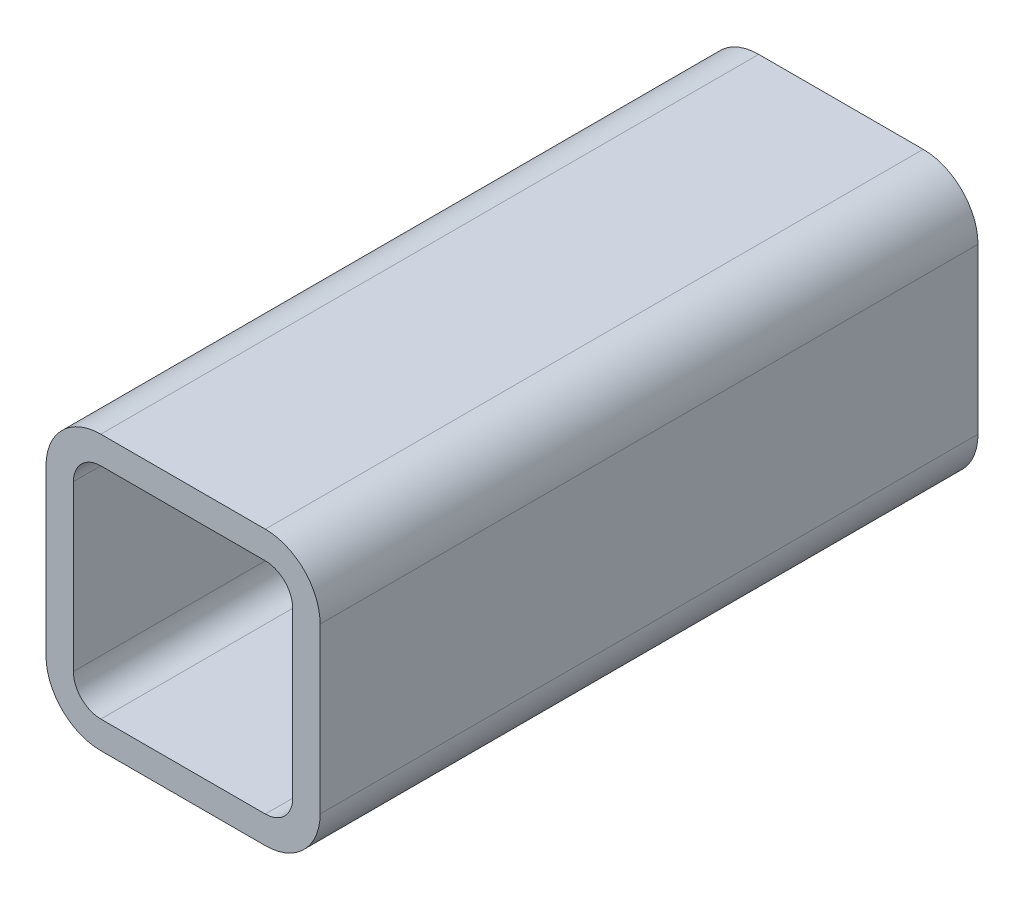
SolidWorks part; units mm, degrees
ref_plane "Front Plane" through (0, 0, 0) normal (0, 0, 1) x (1, 0, 0)
ref_plane "Top Plane" through (0, 0, 0) normal (0, 1, 0) x (1, 0, 0)
ref_plane "Right Plane" through (0, 0, 0) normal (1, 0, 0) x (0, 0, -1)
sketch "Sketch1" plane through (0, 0, 0) normal (0, 0, 1) x (1, 0, 0)
sketch_block_instance "HSS5x5x0.500-1"
sketch_block "HSS5x5x0.500"
extrude "Boss-Extrude1" add sketch "Sketch1" along normal blind 304.8
